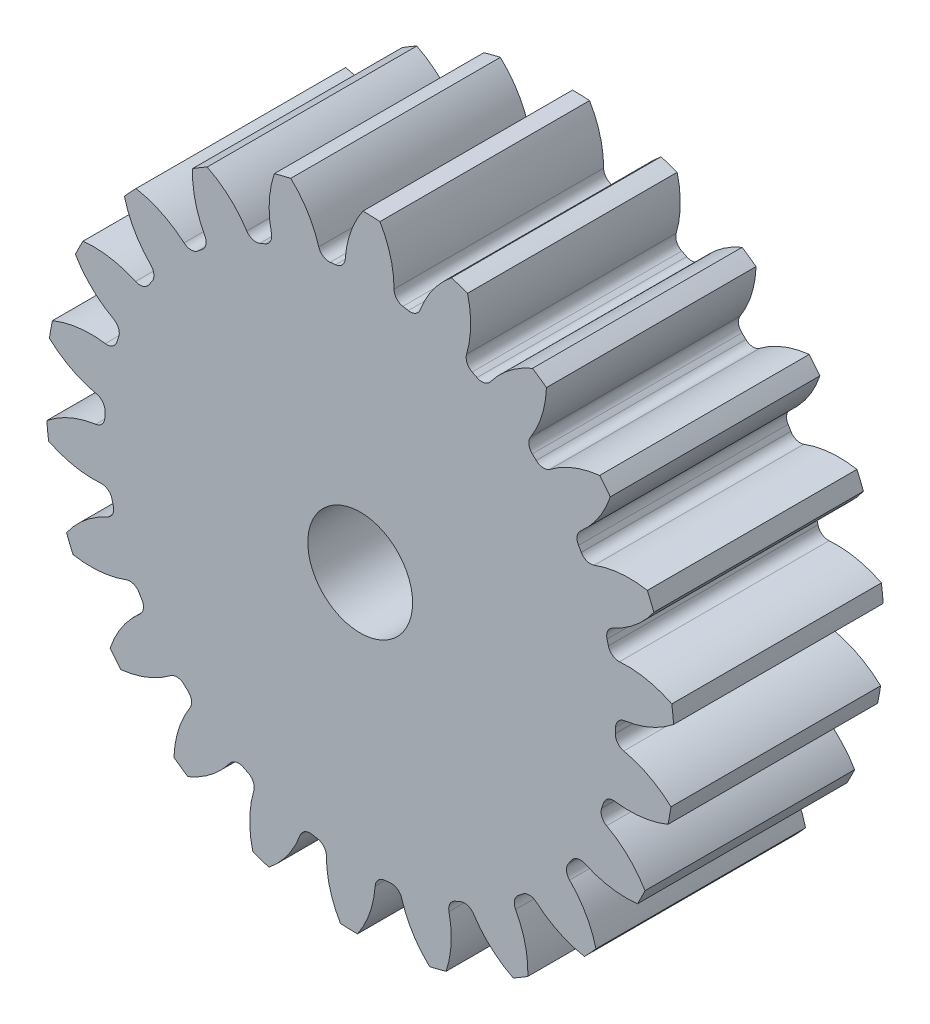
SolidWorks part; units mm, degrees
ref_plane "Front" through (0, 0, 0) normal (0, 0, 1) x (1, 0, 0)
ref_plane "Top" through (0, 0, 0) normal (0, 1, 0) x (1, 0, 0)
ref_plane "Right" through (0, 0, 0) normal (1, 0, 0) x (0, 0, -1)
sketch "Sketch3" plane through (0, 0, 0) normal (0, 0, 1) x (1, 0, 0)
  circle A0 centre (0, 0) radius 152.4
  dimension "od" = 304.8
extrude "gearBody" add sketch "Sketch3" along normal blind 101.6
sketch "Sketch2" plane through (0, 0, 0) normal (0, 0, 1) x (1, 0, 0)
  line L0 (0, 0) -> (121.2823, 50.2368) construction
  line L1 (151.1085, -23.4457) -> (0, 0) construction
  line L2 (0, 0) -> (36.3143, 0) construction
  line L3 (139.6127, 4.9384) -> (138.9, -14.9288) construction
  line L5 (139.2564, -4.9952) -> (0, 0) construction
  line L7 (0, 0) -> (131.2751, 0) construction
  arc A0 (131.2532, 2.3982) -> (130.744, -11.7962) centre (0, 0) ccw construction
  arc A1 (151.9139, 12.1624) -> (150.652, -23.0157) centre (0, 0) ccw construction
  arc A2 (139.6127, 4.9384) -> (138.9, -14.9288) centre (0, 0) ccw construction
  arc A3 (123.6911, -5.7559) -> (123.7857, -3.1213) centre (0, 0) ccw
  arc A4 (151.1085, -23.4457) -> (127.756, -11.047) centre (117.3712, -58.7975) ccw
  arc A5 (151.1085, -23.4457) -> (152.4, 12.5587) centre (0, 0) ccw
  arc A6 (152.4, 12.5587) -> (128.2192, 1.865) centre (121.2823, 50.2368) cw
  arc A7 (123.7857, -3.1213) -> (128.2192, 1.865) centre (128.9529, -3.2515) cw
  arc A8 (127.756, -11.047) -> (123.6911, -5.7559) centre (128.8545, -5.9962) cw
  point P6 (152.4, 12.5587)
  point P22 (151.1085, -23.4457)
  dimension "baseDia" = 262.5501
  dimension "od" = 304.8
  dimension "pd" = 279.4
  dimension "rd" = 247.65
  dimension "rFillet" = 5.1689
  dimension "pointX" = 152.4
  dimension "pointY" = 12.5587
  dimension "CTT" = 19.8672
  dimension "flankCenterAngle" = 22.5
extrude "toothCut" cut sketch "Sketch2" along normal through all
pattern_circular "CirPattern1" count 22 over 360 about axis through (0, 0, 0) along (0, 0, 1) of "toothCut"
sketch "hub1Dia" plane through (0, 0, 0) normal (0, 0, -1) x (-1, 0, 0)
  circle A0 centre (0, 0) radius 12.7
  dimension "hub1Dia" = 25.4
sketch "hub2Dia" plane through (0, 0, 101.6) normal (0, 0, 1) x (1, 0, 0)
  circle A0 centre (0, 0) radius 12.7
  dimension "hub2dia" = 25.4
sketch "boreDia" plane through (0, 0, 0) normal (0, 0, 1) x (1, 0, 0)
  circle A0 centre (0, 0) radius 25.4
  dimension "boreDia" = 50.8
extrude "bore" cut sketch "boreDia" against normal mid plane 25400
